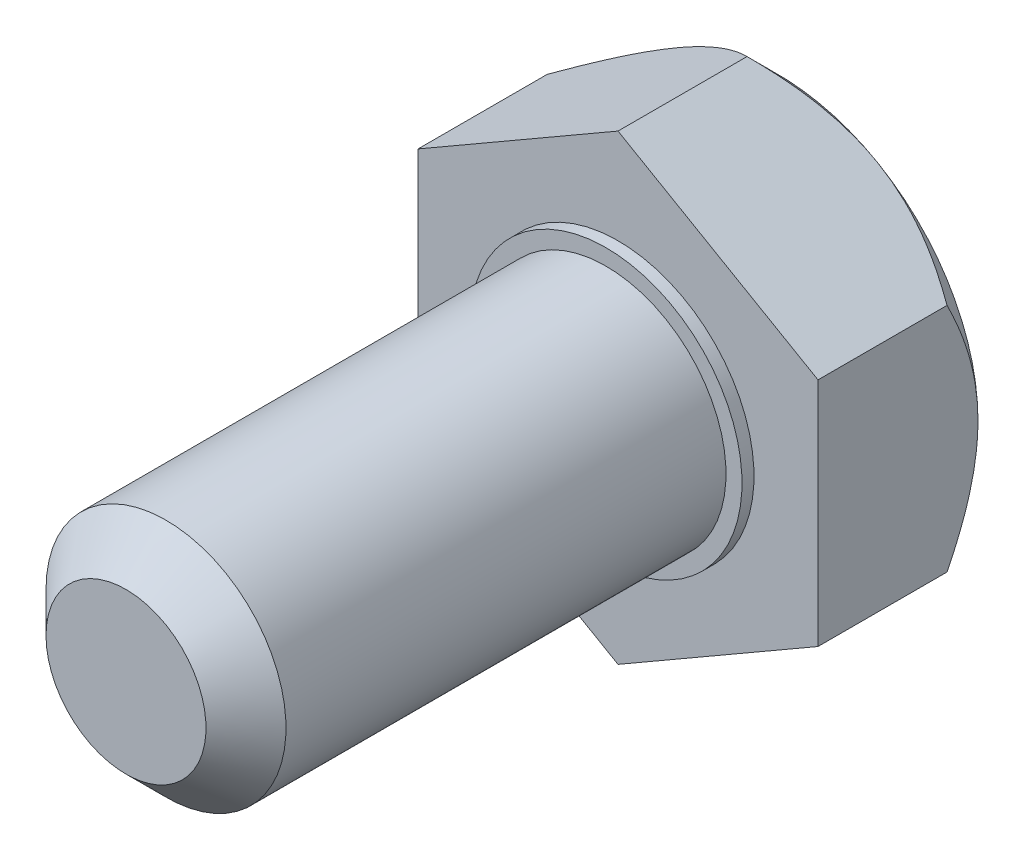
SolidWorks part; units mm, degrees
ref_plane "Front" through (0, 0, 0) normal (0, 0, 1) x (1, 0, 0)
ref_plane "Top" through (0, 0, 0) normal (0, 1, 0) x (1, 0, 0)
ref_plane "Right" through (0, 0, 0) normal (1, 0, 0) x (0, 0, -1)
sketch "Sketch1" plane through (0, 0, 0) normal (0, 0, 1) x (1, 0, 0)
  line L0 (0, 0) -> (0, 5.7735) construction
  line L1 (0, 0) -> (-5, 0) construction
  line L2 (5, 2.8868) -> (5, -2.8868)
  line L3 (5, 2.8868) -> (0, 5.7735)
  line L4 (-5, 2.8868) -> (0, 5.7735)
  line L5 (-5, 2.8868) -> (-5, -2.8868)
  line L6 (-5, -2.8868) -> (0, -5.7735)
  line L7 (5, -2.8868) -> (0, -5.7735)
  point P12 (5, 0)
  dimension "D1" = 60
  dimension "s" = 10
extrude "Base-Extrude" add sketch "Sketch1" along normal mid plane 4
sketch "Sketch3" plane through (0, 0, 0) normal (0, 1, 0) x (1, 0, 0)
  line L1 (-5, 2) -> (0, 2) construction
  line L2 (-5, -2) -> (-5, 2) construction
  line L3 (-10, 2) -> (-5, 2)
  line L4 (-5, 2) -> (-10, -3)
  line L5 (-10, -3) -> (-10, 2)
  line L6 (0, 2) -> (0, -3.8824) construction
  dimension "D1" = 5
  dimension "D2" = 45
revolve "Cut-Revolve1" cut sketch "Sketch3" angle 360 about L6
sketch "Sketch5" plane through (0, 0, 2) normal (0, 0, 1) x (1, 0, 0)
  circle A0 centre (0, 0) radius 3.4
  dimension "dw" = 6.8
extrude "Boss-Extrude1" add sketch "Sketch5" along normal blind 0.3
sketch "Sketch6" plane through (0, 0, 2.3) normal (0, 0, 1) x (1, 0, 0)
  circle A0 centre (0, 0) radius 3
  dimension "d" = 6
extrude "Boss-Extrude2" add sketch "Sketch6" along normal blind 12
chamfer "Chamfer1" distance 1 angle 45 1 edges at (3, 0, 14.3)
